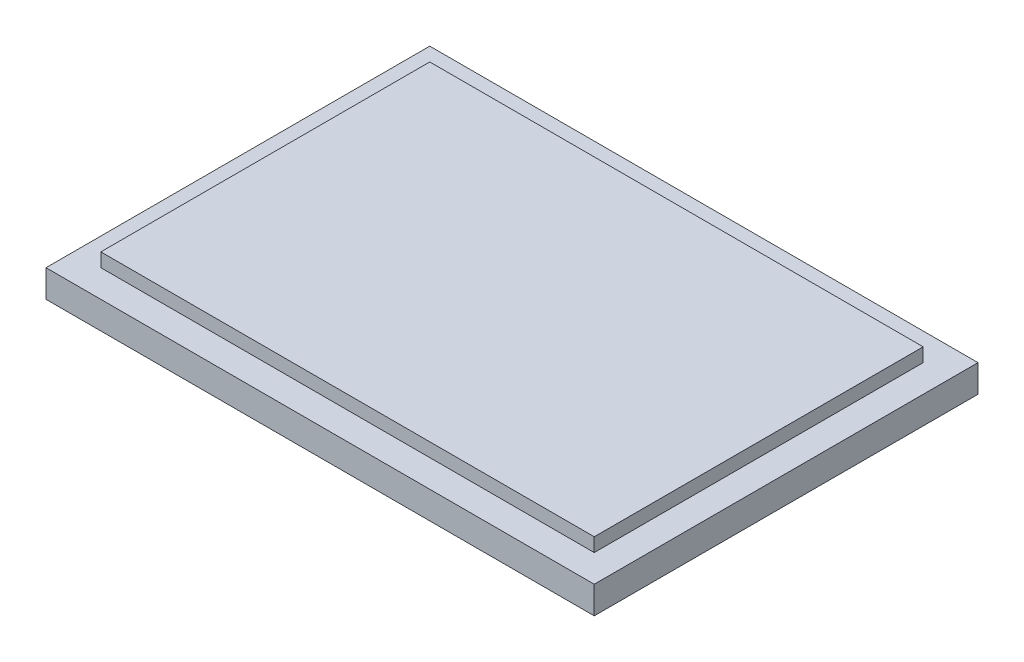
SolidWorks part; units mm, degrees
ref_plane "Front Plane" through (0, 0, 0) normal (0, 0, 1) x (1, 0, 0)
ref_plane "Top Plane" through (0, 0, 0) normal (0, 1, 0) x (1, 0, 0)
ref_plane "Right Plane" through (0, 0, 0) normal (1, 0, 0) x (0, 0, -1)
sketch "Sketch1" plane through (0, 0, 0) normal (0, 1, 0) x (1, 0, 0)
  line L1 (-41.3183, 25.2552) -> (85.6817, 25.2552)
  line L2 (-41.3183, 25.2552) -> (-41.3183, -63.6448)
  line L3 (-41.3183, -63.6448) -> (85.6817, -63.6448)
  line L4 (85.6817, 25.2552) -> (85.6817, -63.6448)
  dimension "D1" = 88.9
  dimension "D2" = 127
extrude "Boss-Extrude1" add sketch "Sketch1" along normal blind 6.35
sketch "Sketch2" plane through (0, 6.35, 0) normal (0, 1, 0) x (1, 0, 0)
  line L0 (-41.3183, 25.2552) -> (-41.3183, -63.6448) construction
  line L1 (-34.9683, 18.9052) -> (79.3317, 18.9052)
  line L2 (-34.9683, 18.9052) -> (-34.9683, -57.2948)
  line L3 (-34.9683, -57.2948) -> (79.3317, -57.2948)
  line L4 (79.3317, 18.9052) -> (79.3317, -57.2948)
  line L5 (85.6817, 25.2552) -> (-41.3183, 25.2552) construction
  dimension "D1" = 114.3
  dimension "D2" = 76.2
  dimension "D3" = 6.35
  dimension "D4" = 6.35
extrude "Boss-Extrude2" add sketch "Sketch2" along normal blind 3.175
